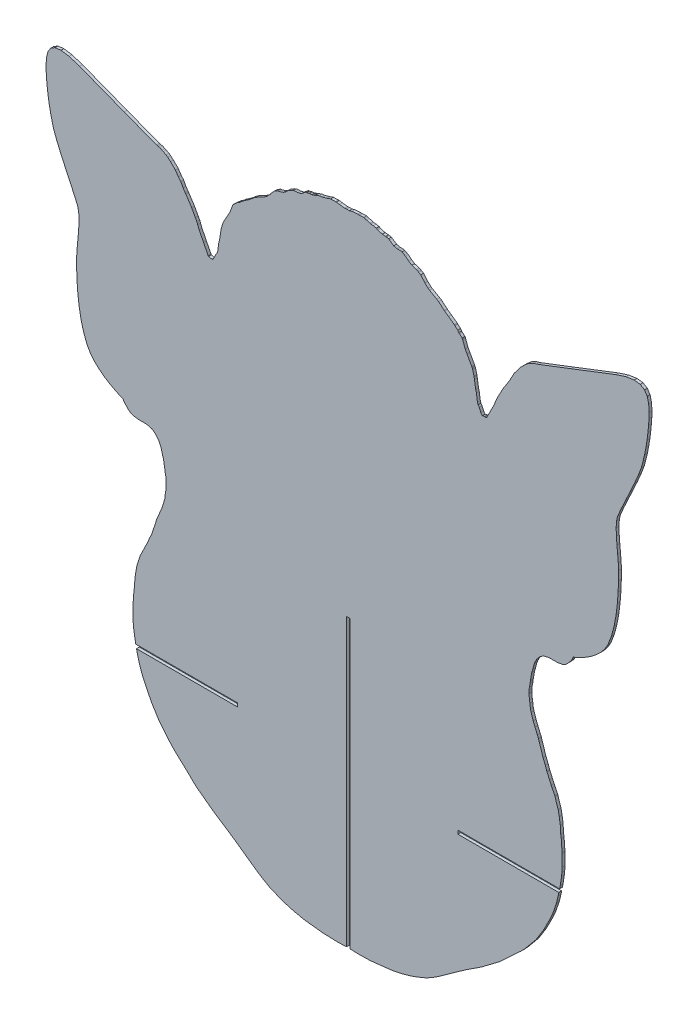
SolidWorks part; units mm, degrees
ref_plane "Спереди" through (0, 0, 0) normal (0, 0, 1) x (1, 0, 0)
ref_plane "Сверху" through (0, 0, 0) normal (0, 1, 0) x (1, 0, 0)
ref_plane "Справа" through (0, 0, 0) normal (1, 0, 0) x (0, 0, -1)
sketch "Model" plane through (0, 0, 0) normal (0, 0, 1) x (1, 0, 0)
  line L0 (-5480.3282, -943.7003) -> (-5481.4679, -943.914)
  line L1 (-5481.4679, -943.914) -> (-5484.9872, -944.6862)
  line L2 (-5484.9872, -944.6862) -> (-5485.7073, -944.8046)
  line L3 (-5485.7073, -944.8046) -> (-5489.5797, -945.2389)
  line L4 (-5489.5797, -945.2389) -> (-5498.2966, -946.2631)
  line L5 (-5498.2966, -946.2631) -> (-5502.5798, -946.5819)
  line L6 (-5502.5798, -946.5819) -> (-5509.2475, -946.6767)
  line L7 (-5509.2475, -946.6767) -> (-5509.9731, -946.6588)
  line L8 (-5509.9731, -946.6588) -> (-5510.6986, -946.641)
  line L9 (-5510.6986, -946.641) -> (-5515.4684, -946.5092)
  line L10 (-5515.4684, -946.5092) -> (-5515.4684, -744.1046)
  line L11 (-5515.4684, -744.1046) -> (-5515.7184, -744.1046)
  line L12 (-5515.7184, -744.1046) -> (-5517.7184, -744.1046)
  line L13 (-5517.7184, -744.1046) -> (-5517.9684, -744.1046)
  line L14 (-5517.9684, -744.1046) -> (-5517.9684, -946.5093)
  line L15 (-5517.9684, -946.5093) -> (-5518.7211, -946.5311)
  line L16 (-5518.7211, -946.5311) -> (-5524.7654, -946.6789)
  line L17 (-5524.7654, -946.6789) -> (-5529.1477, -946.5209)
  line L18 (-5529.1477, -946.5209) -> (-5532.9642, -946.3952)
  line L19 (-5532.9642, -946.3952) -> (-5533.209, -946.4022)
  line L20 (-5533.209, -946.4022) -> (-5533.4537, -946.4093)
  line L21 (-5533.4537, -946.4093) -> (-5534.1791, -946.3847)
  line L22 (-5534.1791, -946.3847) -> (-5547.6379, -944.8563)
  line L23 (-5547.6379, -944.8563) -> (-5548.7945, -944.6618)
  line L24 (-5548.7945, -944.6618) -> (-5551.8003, -943.9579)
  line L25 (-5551.8003, -943.9579) -> (-5554.9713, -943.3454)
  line L26 (-5554.9713, -943.3454) -> (-5560.0283, -941.9174)
  line L27 (-5560.0283, -941.9174) -> (-5562.8963, -940.9633)
  line L28 (-5562.8963, -940.9633) -> (-5565.7023, -939.9208)
  line L29 (-5565.7023, -939.9208) -> (-5572.2742, -937.2243)
  line L30 (-5572.2742, -937.2243) -> (-5572.3351, -937.193)
  line L31 (-5572.3351, -937.193) -> (-5572.3961, -937.1618)
  line L32 (-5572.3961, -937.1618) -> (-5577.7333, -934.049)
  line L33 (-5577.7333, -934.049) -> (-5580.4381, -932.31)
  line L34 (-5580.4381, -932.31) -> (-5584.6052, -929.391)
  line L35 (-5584.6052, -929.391) -> (-5594.3396, -922.4525)
  line L36 (-5594.3396, -922.4525) -> (-5598.0301, -919.9132)
  line L37 (-5598.0301, -919.9132) -> (-5601.2709, -917.6901)
  line L38 (-5601.2709, -917.6901) -> (-5609.4952, -912.3563)
  line L39 (-5609.4952, -912.3563) -> (-5613.0819, -909.8378)
  line L40 (-5613.0819, -909.8378) -> (-5618.4548, -905.8397)
  line L41 (-5618.4548, -905.8397) -> (-5623.7762, -901.9018)
  line L42 (-5623.7762, -901.9018) -> (-5625.6459, -900.267)
  line L43 (-5625.6459, -900.267) -> (-5628.2134, -897.706)
  line L44 (-5628.2134, -897.706) -> (-5639.4595, -887.1359)
  line L45 (-5639.4595, -887.1359) -> (-5641.9636, -884.598)
  line L46 (-5641.9636, -884.598) -> (-5642.1928, -884.3131)
  line L47 (-5642.1928, -884.3131) -> (-5642.422, -884.0285)
  line L48 (-5642.422, -884.0285) -> (-5642.956, -883.4528)
  line L49 (-5642.956, -883.4528) -> (-5648.5054, -876.7374)
  line L50 (-5648.5054, -876.7374) -> (-5650.1177, -874.8195)
  line L51 (-5650.1177, -874.8195) -> (-5650.2498, -874.6527)
  line L52 (-5650.2498, -874.6527) -> (-5650.3819, -874.4862)
  line L53 (-5650.3819, -874.4862) -> (-5650.5482, -874.2538)
  line L54 (-5650.5482, -874.2538) -> (-5655.548, -866.2121)
  line L55 (-5655.548, -866.2121) -> (-5655.7403, -865.872)
  line L56 (-5655.7403, -865.872) -> (-5655.9327, -865.5321)
  line L57 (-5655.9327, -865.5321) -> (-5659.6792, -858.1508)
  line L58 (-5659.6792, -858.1508) -> (-5661.7837, -853.7121)
  line L59 (-5661.7837, -853.7121) -> (-5662.8868, -850.8329)
  line L60 (-5662.8868, -850.8329) -> (-5664.802, -845.0885)
  line L61 (-5664.802, -845.0885) -> (-5665.1398, -843.8568)
  line L62 (-5665.1398, -843.8568) -> (-5666.0983, -839.8727)
  line L63 (-5666.0983, -839.8727) -> (-5666.465, -838.1151)
  line L64 (-5666.465, -838.1151) -> (-5595.0964, -838.1151)
  line L65 (-5595.0964, -838.1151) -> (-5595.0964, -837.8651)
  line L66 (-5595.0964, -837.8651) -> (-5595.0964, -835.8651)
  line L67 (-5595.0964, -835.8651) -> (-5595.0964, -835.6151)
  line L68 (-5595.0964, -835.6151) -> (-5666.9868, -835.6151)
  line L69 (-5666.9868, -835.6151) -> (-5667.5786, -832.7787)
  line L70 (-5667.5786, -832.7787) -> (-5668.5532, -826.4984)
  line L71 (-5668.5532, -826.4984) -> (-5668.7746, -824.0397)
  line L72 (-5668.7746, -824.0397) -> (-5668.9908, -820.8112)
  line L73 (-5668.9908, -820.8112) -> (-5668.9731, -812.4186)
  line L74 (-5668.9731, -812.4186) -> (-5668.9436, -811.4315)
  line L75 (-5668.9436, -811.4315) -> (-5668.7493, -809.736)
  line L76 (-5668.7493, -809.736) -> (-5668.3181, -803.518)
  line L77 (-5668.3181, -803.518) -> (-5667.9446, -801.1095)
  line L78 (-5667.9446, -801.1095) -> (-5667.6075, -795.5792)
  line L79 (-5667.6075, -795.5792) -> (-5666.902, -790.819)
  line L80 (-5666.902, -790.819) -> (-5666.159, -787.0126)
  line L81 (-5666.159, -787.0126) -> (-5663.9006, -780.0443)
  line L82 (-5663.9006, -780.0443) -> (-5663.8545, -779.8974)
  line L83 (-5663.8545, -779.8974) -> (-5663.7923, -779.7201)
  line L84 (-5663.7923, -779.7201) -> (-5663.7233, -779.5624)
  line L85 (-5663.7233, -779.5624) -> (-5661.8575, -775.6896)
  line L86 (-5661.8575, -775.6896) -> (-5658.0781, -767.8864)
  line L87 (-5658.0781, -767.8864) -> (-5657.5495, -766.4398)
  line L88 (-5657.5495, -766.4398) -> (-5655.4711, -761.8165)
  line L89 (-5655.4711, -761.8165) -> (-5652.8164, -753.7411)
  line L90 (-5652.8164, -753.7411) -> (-5652.3174, -752.0829)
  line L91 (-5652.3174, -752.0829) -> (-5652.2287, -751.7782)
  line L92 (-5652.2287, -751.7782) -> (-5652.167, -751.6234)
  line L93 (-5652.167, -751.6234) -> (-5651.4176, -749.8839)
  line L94 (-5651.4176, -749.8839) -> (-5649.7695, -745.9193)
  line L95 (-5649.7695, -745.9193) -> (-5648.4568, -742.8124)
  line L96 (-5648.4568, -742.8124) -> (-5647.0221, -738.2016)
  line L97 (-5647.0221, -738.2016) -> (-5646.525, -736.402)
  line L98 (-5646.525, -736.402) -> (-5646.1612, -733.2125)
  line L99 (-5646.1612, -733.2125) -> (-5645.8202, -731.3319)
  line L100 (-5645.8202, -731.3319) -> (-5645.5793, -727.8876)
  line L101 (-5645.5793, -727.8876) -> (-5645.51, -724.1242)
  line L102 (-5645.51, -724.1242) -> (-5645.8216, -722.0116)
  line L103 (-5645.8216, -722.0116) -> (-5646.3486, -719.3195)
  line L104 (-5646.3486, -719.3195) -> (-5646.4325, -718.2033)
  line L105 (-5646.4325, -718.2033) -> (-5646.5751, -717.341)
  line L106 (-5646.5751, -717.341) -> (-5647.464, -712.3627)
  line L107 (-5647.464, -712.3627) -> (-5648.1461, -709.9806)
  line L108 (-5648.1461, -709.9806) -> (-5649.1175, -706.2814)
  line L109 (-5649.1175, -706.2814) -> (-5649.7402, -704.7699)
  line L110 (-5649.7402, -704.7699) -> (-5650.8364, -702.5658)
  line L111 (-5650.8364, -702.5658) -> (-5651.0222, -702.3151)
  line L112 (-5651.0222, -702.3151) -> (-5651.208, -702.0644)
  line L113 (-5651.208, -702.0644) -> (-5653.1512, -699.7926)
  line L114 (-5653.1512, -699.7926) -> (-5653.2987, -699.6356)
  line L115 (-5653.2987, -699.6356) -> (-5653.3936, -699.5912)
  line L116 (-5653.3936, -699.5912) -> (-5653.4885, -699.547)
  line L117 (-5653.4885, -699.547) -> (-5655.5515, -698.0504)
  line L118 (-5655.5515, -698.0504) -> (-5658.9829, -697.1823)
  line L119 (-5658.9829, -697.1823) -> (-5659.2673, -697.1222)
  line L120 (-5659.2673, -697.1222) -> (-5659.5516, -697.0624)
  line L121 (-5659.5516, -697.0624) -> (-5663.3475, -697.036)
  line L122 (-5663.3475, -697.036) -> (-5665.6954, -696.9938)
  line L123 (-5665.6954, -696.9938) -> (-5669.3225, -696.3642)
  line L124 (-5669.3225, -696.3642) -> (-5669.5002, -696.3197)
  line L125 (-5669.5002, -696.3197) -> (-5669.678, -696.2755)
  line L126 (-5669.678, -696.2755) -> (-5670.0395, -696.1017)
  line L127 (-5670.0395, -696.1017) -> (-5670.401, -695.9279)
  line L128 (-5670.401, -695.9279) -> (-5671.8032, -694.9801)
  line L129 (-5671.8032, -694.9801) -> (-5672.995, -693.7836)
  line L130 (-5672.995, -693.7836) -> (-5675.2873, -691.2702)
  line L131 (-5675.2873, -691.2702) -> (-5675.8777, -690.2272)
  line L132 (-5675.8777, -690.2272) -> (-5676.0145, -689.9254)
  line L133 (-5676.0145, -689.9254) -> (-5680.4875, -687.9752)
  line L134 (-5680.4875, -687.9752) -> (-5684.8447, -685.7033)
  line L135 (-5684.8447, -685.7033) -> (-5688.9852, -683.1127)
  line L136 (-5688.9852, -683.1127) -> (-5692.8074, -680.2062)
  line L137 (-5692.8074, -680.2062) -> (-5696.2102, -676.9867)
  line L138 (-5696.2102, -676.9867) -> (-5699.0921, -673.4577)
  line L139 (-5699.0921, -673.4577) -> (-5701.3524, -669.6215)
  line L140 (-5701.3524, -669.6215) -> (-5703.8401, -663.1244)
  line L141 (-5703.8401, -663.1244) -> (-5705.722, -656.0656)
  line L142 (-5705.722, -656.0656) -> (-5707.0797, -648.6776)
  line L143 (-5707.0797, -648.6776) -> (-5707.9941, -641.1933)
  line L144 (-5707.9941, -641.1933) -> (-5708.5466, -633.8449)
  line L145 (-5708.5466, -633.8449) -> (-5708.8183, -626.8654)
  line L146 (-5708.8183, -626.8654) -> (-5708.891, -620.4872)
  line L147 (-5708.891, -620.4872) -> (-5708.6495, -615.901)
  line L148 (-5708.6495, -615.901) -> (-5708.208, -610.8058)
  line L149 (-5708.208, -610.8058) -> (-5707.7146, -605.4828)
  line L150 (-5707.7146, -605.4828) -> (-5707.3166, -600.2123)
  line L151 (-5707.3166, -600.2123) -> (-5707.1621, -595.275)
  line L152 (-5707.1621, -595.275) -> (-5707.3987, -590.952)
  line L153 (-5707.3987, -590.952) -> (-5708.1744, -587.5241)
  line L154 (-5708.1744, -587.5241) -> (-5710.7914, -581.6146)
  line L155 (-5710.7914, -581.6146) -> (-5713.8507, -575.0158)
  line L156 (-5713.8507, -575.0158) -> (-5717.0757, -568.1154)
  line L157 (-5717.0757, -568.1154) -> (-5720.189, -561.3007)
  line L158 (-5720.189, -561.3007) -> (-5722.9137, -554.9591)
  line L159 (-5722.9137, -554.9591) -> (-5724.9726, -549.4784)
  line L160 (-5724.9726, -549.4784) -> (-5726.089, -545.2455)
  line L161 (-5726.089, -545.2455) -> (-5727.2274, -540.5304)
  line L162 (-5727.2274, -540.5304) -> (-5728.2004, -535.5941)
  line L163 (-5728.2004, -535.5941) -> (-5729.0046, -530.5895)
  line L164 (-5729.0046, -530.5895) -> (-5729.6358, -525.6693)
  line L165 (-5729.6358, -525.6693) -> (-5730.0913, -520.9862)
  line L166 (-5730.0913, -520.9862) -> (-5730.3669, -516.6928)
  line L167 (-5730.3669, -516.6928) -> (-5730.4597, -512.942)
  line L168 (-5730.4597, -512.942) -> (-5730.1595, -507.8295)
  line L169 (-5730.1595, -507.8295) -> (-5729.1362, -503.7047)
  line L170 (-5729.1362, -503.7047) -> (-5727.2065, -500.6715)
  line L171 (-5727.2065, -500.6715) -> (-5724.1858, -498.8336)
  line L172 (-5724.1858, -498.8336) -> (-5719.8906, -498.2956)
  line L173 (-5719.8906, -498.2956) -> (-5714.1369, -499.1608)
  line L174 (-5714.1369, -499.1608) -> (-5706.7412, -501.5338)
  line L175 (-5706.7412, -501.5338) -> (-5675.2114, -513.7157)
  line L176 (-5675.2114, -513.7157) -> (-5652.416, -522.4633)
  line L177 (-5652.416, -522.4633) -> (-5652.1168, -522.5675)
  line L178 (-5652.1168, -522.5675) -> (-5651.6053, -522.6749)
  line L179 (-5651.6053, -522.6749) -> (-5651.0937, -522.7824)
  line L180 (-5651.0937, -522.7824) -> (-5649.979, -523.0319)
  line L181 (-5649.979, -523.0319) -> (-5649.2732, -523.381)
  line L182 (-5649.2732, -523.381) -> (-5648.5674, -523.7301)
  line L183 (-5648.5674, -523.7301) -> (-5648.5332, -523.747)
  line L184 (-5648.5332, -523.747) -> (-5648.499, -523.7638)
  line L185 (-5648.499, -523.7638) -> (-5647.5491, -524.2169)
  line L186 (-5647.5491, -524.2169) -> (-5645.5957, -525.202)
  line L187 (-5645.5957, -525.202) -> (-5644.4646, -526.0116)
  line L188 (-5644.4646, -526.0116) -> (-5642.4383, -527.8129)
  line L189 (-5642.4383, -527.8129) -> (-5639.0272, -531.171)
  line L190 (-5639.0272, -531.171) -> (-5636.8758, -534.3612)
  line L191 (-5636.8758, -534.3612) -> (-5635.2434, -536.2531)
  line L192 (-5635.2434, -536.2531) -> (-5633.5255, -539.4433)
  line L193 (-5633.5255, -539.4433) -> (-5632.1069, -541.5485)
  line L194 (-5632.1069, -541.5485) -> (-5631.9238, -541.7914)
  line L195 (-5631.9238, -541.7914) -> (-5631.7407, -542.0343)
  line L196 (-5631.7407, -542.0343) -> (-5631.5747, -542.2726)
  line L197 (-5631.5747, -542.2726) -> (-5627.4895, -548.5265)
  line L198 (-5627.4895, -548.5265) -> (-5624.8483, -553.3466)
  line L199 (-5624.8483, -553.3466) -> (-5623.8199, -555.2082)
  line L200 (-5623.8199, -555.2082) -> (-5623.2071, -556.8449)
  line L201 (-5623.2071, -556.8449) -> (-5622.1518, -559.4469)
  line L202 (-5622.1518, -559.4469) -> (-5619.1284, -565.5426)
  line L203 (-5619.1284, -565.5426) -> (-5615.6935, -572.2125)
  line L204 (-5615.6935, -572.2125) -> (-5615.4671, -572.381)
  line L205 (-5615.4671, -572.381) -> (-5613.0804, -572.9745)
  line L206 (-5613.0804, -572.9745) -> (-5612.5066, -572.5587)
  line L207 (-5612.5066, -572.5587) -> (-5611.5085, -571.1898)
  line L208 (-5611.5085, -571.1898) -> (-5610.2656, -568.2748)
  line L209 (-5610.2656, -568.2748) -> (-5609.4736, -567.2489)
  line L210 (-5609.4736, -567.2489) -> (-5609.0764, -565.9818)
  line L211 (-5609.0764, -565.9818) -> (-5608.3153, -560.6142)
  line L212 (-5608.3153, -560.6142) -> (-5607.816, -558.6759)
  line L213 (-5607.816, -558.6759) -> (-5606.9321, -553.0231)
  line L214 (-5606.9321, -553.0231) -> (-5606.7108, -551.6371)
  line L215 (-5606.7108, -551.6371) -> (-5606.6318, -551.1774)
  line L216 (-5606.6318, -551.1774) -> (-5605.6759, -547.5839)
  line L217 (-5605.6759, -547.5839) -> (-5605.4305, -546.9247)
  line L218 (-5605.4305, -546.9247) -> (-5605.2952, -546.5746)
  line L219 (-5605.2952, -546.5746) -> (-5605.1487, -546.3014)
  line L220 (-5605.1487, -546.3014) -> (-5605.0179, -545.9645)
  line L221 (-5605.0179, -545.9645) -> (-5601.6704, -540.007)
  line L222 (-5601.6704, -540.007) -> (-5600.3481, -537.5839)
  line L223 (-5600.3481, -537.5839) -> (-5598.5994, -532.7929)
  line L224 (-5598.5994, -532.7929) -> (-5598.3504, -532.2145)
  line L225 (-5598.3504, -532.2145) -> (-5598.1966, -531.9672)
  line L226 (-5598.1966, -531.9672) -> (-5596.3104, -530.3249)
  line L227 (-5596.3104, -530.3249) -> (-5594.7095, -528.8905)
  line L228 (-5594.7095, -528.8905) -> (-5593.4126, -528.1823)
  line L229 (-5593.4126, -528.1823) -> (-5591.2128, -526.265)
  line L230 (-5591.2128, -526.265) -> (-5587.1687, -523.4701)
  line L231 (-5587.1687, -523.4701) -> (-5586.6991, -523.1644)
  line L232 (-5586.6991, -523.1644) -> (-5586.4299, -522.9132)
  line L233 (-5586.4299, -522.9132) -> (-5583.0069, -520.0895)
  line L234 (-5583.0069, -520.0895) -> (-5581.8462, -519.339)
  line L235 (-5581.8462, -519.339) -> (-5579.5425, -518.0402)
  line L236 (-5579.5425, -518.0402) -> (-5576.7533, -516.5917)
  line L237 (-5576.7533, -516.5917) -> (-5576.5129, -516.4533)
  line L238 (-5576.5129, -516.4533) -> (-5576.2724, -516.3151)
  line L239 (-5576.2724, -516.3151) -> (-5574.8093, -515.2897)
  line L240 (-5574.8093, -515.2897) -> (-5574.6136, -515.1815)
  line L241 (-5574.6136, -515.1815) -> (-5574.4518, -515.0529)
  line L242 (-5574.4518, -515.0529) -> (-5572.1304, -512.8292)
  line L243 (-5572.1304, -512.8292) -> (-5571.2109, -511.5375)
  line L244 (-5571.2109, -511.5375) -> (-5569.6971, -509.8444)
  line L245 (-5569.6971, -509.8444) -> (-5569.0637, -509.2201)
  line L246 (-5569.0637, -509.2201) -> (-5568.686, -509.036)
  line L247 (-5568.686, -509.036) -> (-5566.5963, -507.6898)
  line L248 (-5566.5963, -507.6898) -> (-5565.8568, -507.6808)
  line L249 (-5565.8568, -507.6808) -> (-5565.452, -507.6134)
  line L250 (-5565.452, -507.6134) -> (-5562.5886, -506.6593)
  line L251 (-5562.5886, -506.6593) -> (-5561.1531, -505.692)
  line L252 (-5561.1531, -505.692) -> (-5559.7425, -504.35)
  line L253 (-5559.7425, -504.35) -> (-5558.6138, -503.5202)
  line L254 (-5558.6138, -503.5202) -> (-5556.6302, -502.4772)
  line L255 (-5556.6302, -502.4772) -> (-5556.5691, -502.4633)
  line L256 (-5556.5691, -502.4633) -> (-5556.508, -502.4494)
  line L257 (-5556.508, -502.4494) -> (-5555.5853, -501.9962)
  line L258 (-5555.5853, -501.9962) -> (-5553.8155, -501.7455)
  line L259 (-5553.8155, -501.7455) -> (-5552.7667, -501.7689)
  line L260 (-5552.7667, -501.7689) -> (-5551.7705, -501.6308)
  line L261 (-5551.7705, -501.6308) -> (-5549.9726, -501.1449)
  line L262 (-5549.9726, -501.1449) -> (-5549.9502, -501.1361)
  line L263 (-5549.9502, -501.1361) -> (-5549.6855, -500.9801)
  line L264 (-5549.6855, -500.9801) -> (-5546.6116, -498.5597)
  line L265 (-5546.6116, -498.5597) -> (-5546.0011, -498.6186)
  line L266 (-5546.0011, -498.6186) -> (-5544.7883, -498.348)
  line L267 (-5544.7883, -498.348) -> (-5544.3656, -498.194)
  line L268 (-5544.3656, -498.194) -> (-5544.1094, -498.1881)
  line L269 (-5544.1094, -498.1881) -> (-5543.8533, -498.1825)
  line L270 (-5543.8533, -498.1825) -> (-5543.1493, -498.1383)
  line L271 (-5543.1493, -498.1383) -> (-5542.4454, -498.0941)
  line L272 (-5542.4454, -498.0941) -> (-5541.1514, -497.4599)
  line L273 (-5541.1514, -497.4599) -> (-5540.2858, -497.3878)
  line L274 (-5540.2858, -497.3878) -> (-5538.978, -496.7028)
  line L275 (-5538.978, -496.7028) -> (-5537.2081, -496.0883)
  line L276 (-5537.2081, -496.0883) -> (-5535.7148, -495.9415)
  line L277 (-5535.7148, -495.9415) -> (-5534.6709, -495.6962)
  line L278 (-5534.6709, -495.6962) -> (-5532.417, -495.0722)
  line L279 (-5532.417, -495.0722) -> (-5531.8631, -494.8859)
  line L280 (-5531.8631, -494.8859) -> (-5531.3093, -494.6996)
  line L281 (-5531.3093, -494.6996) -> (-5529.1798, -493.9962)
  line L282 (-5529.1798, -493.9962) -> (-5525.833, -493.9545)
  line L283 (-5525.833, -493.9545) -> (-5525.733, -493.9601)
  line L284 (-5525.733, -493.9601) -> (-5525.633, -493.9657)
  line L285 (-5525.633, -493.9657) -> (-5525.1904, -493.9069)
  line L286 (-5525.1904, -493.9069) -> (-5524.9759, -493.9481)
  line L287 (-5524.9759, -493.9481) -> (-5522.79, -494.254)
  line L288 (-5522.79, -494.254) -> (-5519.3476, -494.6776)
  line L289 (-5519.3476, -494.6776) -> (-5518.5047, -494.6298)
  line L290 (-5518.5047, -494.6298) -> (-5517.6619, -494.5822)
  line L291 (-5517.6619, -494.5822) -> (-5515.9836, -494.5832)
  line L292 (-5515.9836, -494.5832) -> (-5514.1221, -494.0775)
  line L293 (-5514.1221, -494.0775) -> (-5510.2135, -493.7782)
  line L294 (-5510.2135, -493.7782) -> (-5509.4335, -493.8793)
  line L295 (-5509.4335, -493.8793) -> (-5509.1186, -493.8585)
  line L296 (-5509.1186, -493.8585) -> (-5508.8038, -493.8378)
  line L297 (-5508.8038, -493.8378) -> (-5505.6023, -493.6198)
  line L298 (-5505.6023, -493.6198) -> (-5504.7429, -493.9181)
  line L299 (-5504.7429, -493.9181) -> (-5503.8835, -494.2165)
  line L300 (-5503.8835, -494.2165) -> (-5501.4905, -495.0177)
  line L301 (-5501.4905, -495.0177) -> (-5501.0812, -495.1391)
  line L302 (-5501.0812, -495.1391) -> (-5500.672, -495.2604)
  line L303 (-5500.672, -495.2604) -> (-5499.0441, -495.3317)
  line L304 (-5499.0441, -495.3317) -> (-5496.8858, -495.7814)
  line L305 (-5496.8858, -495.7814) -> (-5496.3353, -496.0739)
  line L306 (-5496.3353, -496.0739) -> (-5495.7848, -496.3666)
  line L307 (-5495.7848, -496.3666) -> (-5492.9171, -497.2758)
  line L308 (-5492.9171, -497.2758) -> (-5492.7713, -497.3368)
  line L309 (-5492.7713, -497.3368) -> (-5492.5653, -497.3466)
  line L310 (-5492.5653, -497.3466) -> (-5492.3592, -497.3563)
  line L311 (-5492.3592, -497.3563) -> (-5491.4593, -497.4127)
  line L312 (-5491.4593, -497.4127) -> (-5490.5594, -497.4691)
  line L313 (-5490.5594, -497.4691) -> (-5490.3032, -497.475)
  line L314 (-5490.3032, -497.475) -> (-5490.047, -497.4809)
  line L315 (-5490.047, -497.4809) -> (-5489.8356, -497.5578)
  line L316 (-5489.8356, -497.5578) -> (-5489.6243, -497.6347)
  line L317 (-5489.6243, -497.6347) -> (-5488.2986, -497.9306)
  line L318 (-5488.2986, -497.9306) -> (-5487.649, -498.3234)
  line L319 (-5487.649, -498.3234) -> (-5484.5294, -500.4074)
  line L320 (-5484.5294, -500.4074) -> (-5483.5857, -500.6625)
  line L321 (-5483.5857, -500.6625) -> (-5482.6421, -500.9176)
  line L322 (-5482.6421, -500.9176) -> (-5482.144, -500.9867)
  line L323 (-5482.144, -500.9867) -> (-5481.646, -501.0558)
  line L324 (-5481.646, -501.0558) -> (-5480.5972, -501.0324)
  line L325 (-5480.5972, -501.0324) -> (-5479.7123, -501.1576)
  line L326 (-5479.7123, -501.1576) -> (-5478.8274, -501.2831)
  line L327 (-5478.8274, -501.2831) -> (-5478.311, -501.5365)
  line L328 (-5478.311, -501.5365) -> (-5477.7945, -501.7902)
  line L329 (-5477.7945, -501.7902) -> (-5477.0722, -502.1674)
  line L330 (-5477.0722, -502.1674) -> (-5476.3498, -502.5446)
  line L331 (-5476.3498, -502.5446) -> (-5473.9863, -504.4892)
  line L332 (-5473.9863, -504.4892) -> (-5471.8242, -505.9462)
  line L333 (-5471.8242, -505.9462) -> (-5468.7329, -506.976)
  line L334 (-5468.7329, -506.976) -> (-5468.1564, -507.1933)
  line L335 (-5468.1564, -507.1933) -> (-5467.5099, -507.4064)
  line L336 (-5467.5099, -507.4064) -> (-5466.9015, -507.778)
  line L337 (-5466.9015, -507.778) -> (-5465.4761, -508.6779)
  line L338 (-5465.4761, -508.6779) -> (-5462.5572, -512.0707)
  line L339 (-5462.5572, -512.0707) -> (-5462.495, -512.1395)
  line L340 (-5462.495, -512.1395) -> (-5462.4327, -512.2086)
  line L341 (-5462.4327, -512.2086) -> (-5460.2757, -514.2421)
  line L342 (-5460.2757, -514.2421) -> (-5459.7505, -514.61)
  line L343 (-5459.7505, -514.61) -> (-5459.2253, -514.9779)
  line L344 (-5459.2253, -514.9779) -> (-5454.1313, -517.9074)
  line L345 (-5454.1313, -517.9074) -> (-5452.8856, -518.6735)
  line L346 (-5452.8856, -518.6735) -> (-5448.7702, -522.1593)
  line L347 (-5448.7702, -522.1593) -> (-5448.659, -522.2489)
  line L348 (-5448.659, -522.2489) -> (-5448.5409, -522.3737)
  line L349 (-5448.5409, -522.3737) -> (-5445.9202, -524.2082)
  line L350 (-5445.9202, -524.2082) -> (-5441.748, -527.2067)
  line L351 (-5441.748, -527.2067) -> (-5441.5055, -527.4774)
  line L352 (-5441.5055, -527.4774) -> (-5441.263, -527.7484)
  line L353 (-5441.263, -527.7484) -> (-5439.318, -529.4301)
  line L354 (-5439.318, -529.4301) -> (-5438.5392, -530.6466)
  line L355 (-5438.5392, -530.6466) -> (-5438.3207, -530.8424)
  line L356 (-5438.3207, -530.8424) -> (-5438.1022, -531.0382)
  line L357 (-5438.1022, -531.0382) -> (-5436.216, -532.6806)
  line L358 (-5436.216, -532.6806) -> (-5436.1392, -532.8041)
  line L359 (-5436.1392, -532.8041) -> (-5436.0624, -532.9276)
  line L360 (-5436.0624, -532.9276) -> (-5435.9379, -533.2169)
  line L361 (-5435.9379, -533.2169) -> (-5435.8133, -533.5062)
  line L362 (-5435.8133, -533.5062) -> (-5434.0646, -538.2973)
  line L363 (-5434.0646, -538.2973) -> (-5432.7422, -540.7204)
  line L364 (-5432.7422, -540.7204) -> (-5429.3948, -546.6779)
  line L365 (-5429.3948, -546.6779) -> (-5429.3294, -546.8463)
  line L366 (-5429.3294, -546.8463) -> (-5429.264, -547.0148)
  line L367 (-5429.264, -547.0148) -> (-5429.1174, -547.288)
  line L368 (-5429.1174, -547.288) -> (-5429.0497, -547.4628)
  line L369 (-5429.0497, -547.4628) -> (-5428.982, -547.6378)
  line L370 (-5428.982, -547.6378) -> (-5428.7369, -548.2973)
  line L371 (-5428.7369, -548.2973) -> (-5427.7809, -551.8905)
  line L372 (-5427.7809, -551.8905) -> (-5427.7018, -552.3502)
  line L373 (-5427.7018, -552.3502) -> (-5427.4806, -553.7365)
  line L374 (-5427.4806, -553.7365) -> (-5426.5968, -559.3893)
  line L375 (-5426.5968, -559.3893) -> (-5426.0974, -561.3275)
  line L376 (-5426.0974, -561.3275) -> (-5425.3363, -566.6952)
  line L377 (-5425.3363, -566.6952) -> (-5424.9391, -567.9621)
  line L378 (-5424.9391, -567.9621) -> (-5424.1472, -568.9882)
  line L379 (-5424.1472, -568.9882) -> (-5422.9042, -571.9032)
  line L380 (-5422.9042, -571.9032) -> (-5421.9475, -573.2155)
  line L381 (-5421.9475, -573.2155) -> (-5421.0318, -572.9997)
  line L382 (-5421.0318, -572.9997) -> (-5420.1161, -572.7841)
  line L383 (-5420.1161, -572.7841) -> (-5419.7261, -572.8874)
  line L384 (-5419.7261, -572.8874) -> (-5419.336, -572.9906)
  line L385 (-5419.336, -572.9906) -> (-5418.79, -572.6032)
  line L386 (-5418.79, -572.6032) -> (-5418.017, -571.0536)
  line L387 (-5418.017, -571.0536) -> (-5413.3276, -561.9149)
  line L388 (-5413.3276, -561.9149) -> (-5412.4836, -559.4694)
  line L389 (-5412.4836, -559.4694) -> (-5411.0215, -556.182)
  line L390 (-5411.0215, -556.182) -> (-5407.9211, -550.5192)
  line L391 (-5407.9211, -550.5192) -> (-5407.3613, -549.4335)
  line L392 (-5407.3613, -549.4335) -> (-5406.9536, -548.7411)
  line L393 (-5406.9536, -548.7411) -> (-5403.0954, -542.7123)
  line L394 (-5403.0954, -542.7123) -> (-5403.0553, -542.6544)
  line L395 (-5403.0553, -542.6544) -> (-5403.0152, -542.5966)
  line L396 (-5403.0152, -542.5966) -> (-5402.9324, -542.4853)
  line L397 (-5402.9324, -542.4853) -> (-5402.8496, -542.3742)
  line L398 (-5402.8496, -542.3742) -> (-5399.1693, -535.5397)
  line L399 (-5399.1693, -535.5397) -> (-5397.5367, -533.6478)
  line L400 (-5397.5367, -533.6478) -> (-5395.3855, -530.4579)
  line L401 (-5395.3855, -530.4579) -> (-5391.9742, -527.0998)
  line L402 (-5391.9742, -527.0998) -> (-5389.9482, -525.2985)
  line L403 (-5389.9482, -525.2985) -> (-5389.3826, -524.8937)
  line L404 (-5389.3826, -524.8937) -> (-5388.817, -524.4889)
  line L405 (-5388.817, -524.4889) -> (-5386.8636, -523.5036)
  line L406 (-5386.8636, -523.5036) -> (-5385.2971, -522.7562)
  line L407 (-5385.2971, -522.7562) -> (-5383.4862, -522.2697)
  line L408 (-5383.4862, -522.2697) -> (-5381.9968, -521.7499)
  line L409 (-5381.9968, -521.7499) -> (-5359.2013, -513.0026)
  line L410 (-5359.2013, -513.0026) -> (-5327.6714, -500.8205)
  line L411 (-5327.6714, -500.8205) -> (-5320.2755, -498.4474)
  line L412 (-5320.2755, -498.4474) -> (-5314.5221, -497.5822)
  line L413 (-5314.5221, -497.5822) -> (-5310.227, -498.1205)
  line L414 (-5310.227, -498.1205) -> (-5307.2063, -499.9582)
  line L415 (-5307.2063, -499.9582) -> (-5305.2764, -502.9916)
  line L416 (-5305.2764, -502.9916) -> (-5304.2532, -507.1164)
  line L417 (-5304.2532, -507.1164) -> (-5303.953, -512.2287)
  line L418 (-5303.953, -512.2287) -> (-5304.0456, -515.9794)
  line L419 (-5304.0456, -515.9794) -> (-5304.3213, -520.2728)
  line L420 (-5304.3213, -520.2728) -> (-5304.7767, -524.956)
  line L421 (-5304.7767, -524.956) -> (-5305.4082, -529.8764)
  line L422 (-5305.4082, -529.8764) -> (-5306.2121, -534.881)
  line L423 (-5306.2121, -534.881) -> (-5307.185, -539.817)
  line L424 (-5307.185, -539.817) -> (-5308.3236, -544.5324)
  line L425 (-5308.3236, -544.5324) -> (-5309.4398, -548.765)
  line L426 (-5309.4398, -548.765) -> (-5311.4988, -554.2457)
  line L427 (-5311.4988, -554.2457) -> (-5314.2237, -560.5873)
  line L428 (-5314.2237, -560.5873) -> (-5317.3371, -567.4022)
  line L429 (-5317.3371, -567.4022) -> (-5320.562, -574.3026)
  line L430 (-5320.562, -574.3026) -> (-5323.6213, -580.9013)
  line L431 (-5323.6213, -580.9013) -> (-5326.2383, -586.8109)
  line L432 (-5326.2383, -586.8109) -> (-5327.0139, -590.2389)
  line L433 (-5327.0139, -590.2389) -> (-5327.2505, -594.5617)
  line L434 (-5327.2505, -594.5617) -> (-5327.0961, -599.4989)
  line L435 (-5327.0961, -599.4989) -> (-5326.6981, -604.7694)
  line L436 (-5326.6981, -604.7694) -> (-5326.2046, -610.0927)
  line L437 (-5326.2046, -610.0927) -> (-5325.7632, -615.1876)
  line L438 (-5325.7632, -615.1876) -> (-5325.5217, -619.7738)
  line L439 (-5325.5217, -619.7738) -> (-5325.5941, -626.152)
  line L440 (-5325.5941, -626.152) -> (-5325.866, -633.1317)
  line L441 (-5325.866, -633.1317) -> (-5326.4186, -640.4801)
  line L442 (-5326.4186, -640.4801) -> (-5327.333, -647.9645)
  line L443 (-5327.333, -647.9645) -> (-5328.6905, -655.3524)
  line L444 (-5328.6905, -655.3524) -> (-5330.5723, -662.4113)
  line L445 (-5330.5723, -662.4113) -> (-5333.0602, -668.9083)
  line L446 (-5333.0602, -668.9083) -> (-5335.2554, -672.6515)
  line L447 (-5335.2554, -672.6515) -> (-5338.0441, -676.1034)
  line L448 (-5338.0441, -676.1034) -> (-5341.3325, -679.2609)
  line L449 (-5341.3325, -679.2609) -> (-5345.0268, -682.1212)
  line L450 (-5345.0268, -682.1212) -> (-5349.0332, -684.6818)
  line L451 (-5349.0332, -684.6818) -> (-5353.2578, -686.9396)
  line L452 (-5353.2578, -686.9396) -> (-5357.6069, -688.892)
  line L453 (-5357.6069, -688.892) -> (-5358.535, -690.9406)
  line L454 (-5358.535, -690.9406) -> (-5359.1252, -691.9835)
  line L455 (-5359.1252, -691.9835) -> (-5361.4177, -694.497)
  line L456 (-5361.4177, -694.497) -> (-5362.6095, -695.6935)
  line L457 (-5362.6095, -695.6935) -> (-5364.0116, -696.6413)
  line L458 (-5364.0116, -696.6413) -> (-5364.7347, -696.9887)
  line L459 (-5364.7347, -696.9887) -> (-5364.9125, -697.0331)
  line L460 (-5364.9125, -697.0331) -> (-5365.0903, -697.0775)
  line L461 (-5365.0903, -697.0775) -> (-5368.7171, -697.7072)
  line L462 (-5368.7171, -697.7072) -> (-5371.0652, -697.7492)
  line L463 (-5371.0652, -697.7492) -> (-5374.8611, -697.7758)
  line L464 (-5374.8611, -697.7758) -> (-5375.4299, -697.8954)
  line L465 (-5375.4299, -697.8954) -> (-5378.8612, -698.7636)
  line L466 (-5378.8612, -698.7636) -> (-5380.9243, -700.2604)
  line L467 (-5380.9243, -700.2604) -> (-5381.0192, -700.3046)
  line L468 (-5381.0192, -700.3046) -> (-5381.1141, -700.3488)
  line L469 (-5381.1141, -700.3488) -> (-5381.2615, -700.5058)
  line L470 (-5381.2615, -700.5058) -> (-5383.2046, -702.7777)
  line L471 (-5383.2046, -702.7777) -> (-5383.3904, -703.0282)
  line L472 (-5383.3904, -703.0282) -> (-5383.5762, -703.279)
  line L473 (-5383.5762, -703.279) -> (-5384.6723, -705.4833)
  line L474 (-5384.6723, -705.4833) -> (-5385.2952, -706.9948)
  line L475 (-5385.2952, -706.9948) -> (-5386.2666, -710.6937)
  line L476 (-5386.2666, -710.6937) -> (-5386.9486, -713.0758)
  line L477 (-5386.9486, -713.0758) -> (-5387.8376, -718.0541)
  line L478 (-5387.8376, -718.0541) -> (-5387.9802, -718.9166)
  line L479 (-5387.9802, -718.9166) -> (-5388.0641, -720.0329)
  line L480 (-5388.0641, -720.0329) -> (-5388.591, -722.7248)
  line L481 (-5388.591, -722.7248) -> (-5388.9028, -724.8375)
  line L482 (-5388.9028, -724.8375) -> (-5388.8749, -726.3441)
  line L483 (-5388.8749, -726.3441) -> (-5388.8483, -726.964)
  line L484 (-5388.8483, -726.964) -> (-5388.5924, -730.6188)
  line L485 (-5388.5924, -730.6188) -> (-5388.2513, -732.4992)
  line L486 (-5388.2513, -732.4992) -> (-5387.8877, -735.6886)
  line L487 (-5387.8877, -735.6886) -> (-5387.3906, -737.4882)
  line L488 (-5387.3906, -737.4882) -> (-5385.956, -742.099)
  line L489 (-5385.956, -742.099) -> (-5384.6431, -745.2062)
  line L490 (-5384.6431, -745.2062) -> (-5382.995, -749.1706)
  line L491 (-5382.995, -749.1706) -> (-5382.2457, -750.9101)
  line L492 (-5382.2457, -750.9101) -> (-5382.1838, -751.0648)
  line L493 (-5382.1838, -751.0648) -> (-5382.0953, -751.3695)
  line L494 (-5382.0953, -751.3695) -> (-5381.5963, -753.0277)
  line L495 (-5381.5963, -753.0277) -> (-5378.9416, -761.1032)
  line L496 (-5378.9416, -761.1032) -> (-5377.37, -764.976)
  line L497 (-5377.37, -764.976) -> (-5376.3668, -767.9218)
  line L498 (-5376.3668, -767.9218) -> (-5376.2588, -768.1789)
  line L499 (-5376.2588, -768.1789) -> (-5376.1507, -768.4362)
  line L500 (-5376.1507, -768.4362) -> (-5374.3494, -772.4123)
  line L501 (-5374.3494, -772.4123) -> (-5373.1434, -775.1884)
  line L502 (-5373.1434, -775.1884) -> (-5372.5552, -776.4027)
  line L503 (-5372.5552, -776.4027) -> (-5370.6894, -780.2758)
  line L504 (-5370.6894, -780.2758) -> (-5370.6203, -780.4335)
  line L505 (-5370.6203, -780.4335) -> (-5370.5893, -780.5221)
  line L506 (-5370.5893, -780.5221) -> (-5370.5582, -780.6107)
  line L507 (-5370.5582, -780.6107) -> (-5370.5121, -780.7577)
  line L508 (-5370.5121, -780.7577) -> (-5368.2538, -787.7257)
  line L509 (-5368.2538, -787.7257) -> (-5367.5106, -791.5324)
  line L510 (-5367.5106, -791.5324) -> (-5366.805, -796.2924)
  line L511 (-5366.805, -796.2924) -> (-5366.468, -801.8227)
  line L512 (-5366.468, -801.8227) -> (-5366.0946, -804.2313)
  line L513 (-5366.0946, -804.2313) -> (-5365.6634, -810.4494)
  line L514 (-5365.6634, -810.4494) -> (-5365.4691, -812.1447)
  line L515 (-5365.4691, -812.1447) -> (-5365.4394, -813.1317)
  line L516 (-5365.4394, -813.1317) -> (-5365.4219, -821.5246)
  line L517 (-5365.4219, -821.5246) -> (-5365.6379, -824.7531)
  line L518 (-5365.6379, -824.7531) -> (-5365.8594, -827.2116)
  line L519 (-5365.8594, -827.2116) -> (-5366.8341, -833.4918)
  line L520 (-5366.8341, -833.4918) -> (-5367.2771, -835.6151)
  line L521 (-5367.2771, -835.6151) -> (-5439.1573, -835.6151)
  line L522 (-5439.1573, -835.6151) -> (-5439.1573, -835.8651)
  line L523 (-5439.1573, -835.8651) -> (-5439.1573, -837.8651)
  line L524 (-5439.1573, -837.8651) -> (-5439.1573, -838.1151)
  line L525 (-5439.1573, -838.1151) -> (-5367.799, -838.1151)
  line L526 (-5367.799, -838.1151) -> (-5368.3146, -840.5858)
  line L527 (-5368.3146, -840.5858) -> (-5369.2728, -844.57)
  line L528 (-5369.2728, -844.57) -> (-5369.6108, -845.8017)
  line L529 (-5369.6108, -845.8017) -> (-5371.5259, -851.546)
  line L530 (-5371.5259, -851.546) -> (-5372.629, -854.4252)
  line L531 (-5372.629, -854.4252) -> (-5374.7335, -858.8642)
  line L532 (-5374.7335, -858.8642) -> (-5378.48, -866.2455)
  line L533 (-5378.48, -866.2455) -> (-5378.6723, -866.5853)
  line L534 (-5378.6723, -866.5853) -> (-5378.8646, -866.9252)
  line L535 (-5378.8646, -866.9252) -> (-5383.8645, -874.9672)
  line L536 (-5383.8645, -874.9672) -> (-5384.0307, -875.1996)
  line L537 (-5384.0307, -875.1996) -> (-5384.1629, -875.3661)
  line L538 (-5384.1629, -875.3661) -> (-5384.2952, -875.5326)
  line L539 (-5384.2952, -875.5326) -> (-5385.9075, -877.4506)
  line L540 (-5385.9075, -877.4506) -> (-5391.4567, -884.1659)
  line L541 (-5391.4567, -884.1659) -> (-5391.794, -884.5297)
  line L542 (-5391.794, -884.5297) -> (-5392.1313, -884.8935)
  line L543 (-5392.1313, -884.8935) -> (-5394.4651, -887.3375)
  line L544 (-5394.4651, -887.3375) -> (-5408.6326, -900.4403)
  line L545 (-5408.6326, -900.4403) -> (-5408.9615, -900.7621)
  line L546 (-5408.9615, -900.7621) -> (-5409.2905, -901.0841)
  line L547 (-5409.2905, -901.0841) -> (-5410.0699, -901.7604)
  line L548 (-5410.0699, -901.7604) -> (-5411.4541, -902.7545)
  line L549 (-5411.4541, -902.7545) -> (-5415.3446, -905.7182)
  line L550 (-5415.3446, -905.7182) -> (-5421.7142, -910.4901)
  line L551 (-5421.7142, -910.4901) -> (-5422.0406, -910.7548)
  line L552 (-5422.0406, -910.7548) -> (-5422.3671, -911.0197)
  line L553 (-5422.3671, -911.0197) -> (-5422.7446, -911.2924)
  line L554 (-5422.7446, -911.2924) -> (-5426.5004, -913.7289)
  line L555 (-5426.5004, -913.7289) -> (-5432.6655, -917.7572)
  line L556 (-5432.6655, -917.7572) -> (-5435.5454, -919.7653)
  line L557 (-5435.5454, -919.7653) -> (-5439.3135, -922.3795)
  line L558 (-5439.3135, -922.3795) -> (-5449.281, -929.5612)
  line L559 (-5449.281, -929.5612) -> (-5453.1617, -932.3202)
  line L560 (-5453.1617, -932.3202) -> (-5455.7375, -933.984)
  line L561 (-5455.7375, -933.984) -> (-5461.1759, -937.1879)
  line L562 (-5461.1759, -937.1879) -> (-5461.1989, -937.1994)
  line L563 (-5461.1989, -937.1994) -> (-5461.2219, -937.2108)
  line L564 (-5461.2219, -937.2108) -> (-5467.5879, -939.8227)
  line L565 (-5467.5879, -939.8227) -> (-5470.4944, -940.9137)
  line L566 (-5470.4944, -940.9137) -> (-5473.225, -941.8048)
  line L567 (-5473.225, -941.8048) -> (-5479.1886, -943.4867)
  line L568 (-5479.1886, -943.4867) -> (-5480.3282, -943.7003)
extrude "Бобышка-Вытянуть1" add sketch "Model" along normal blind 2
